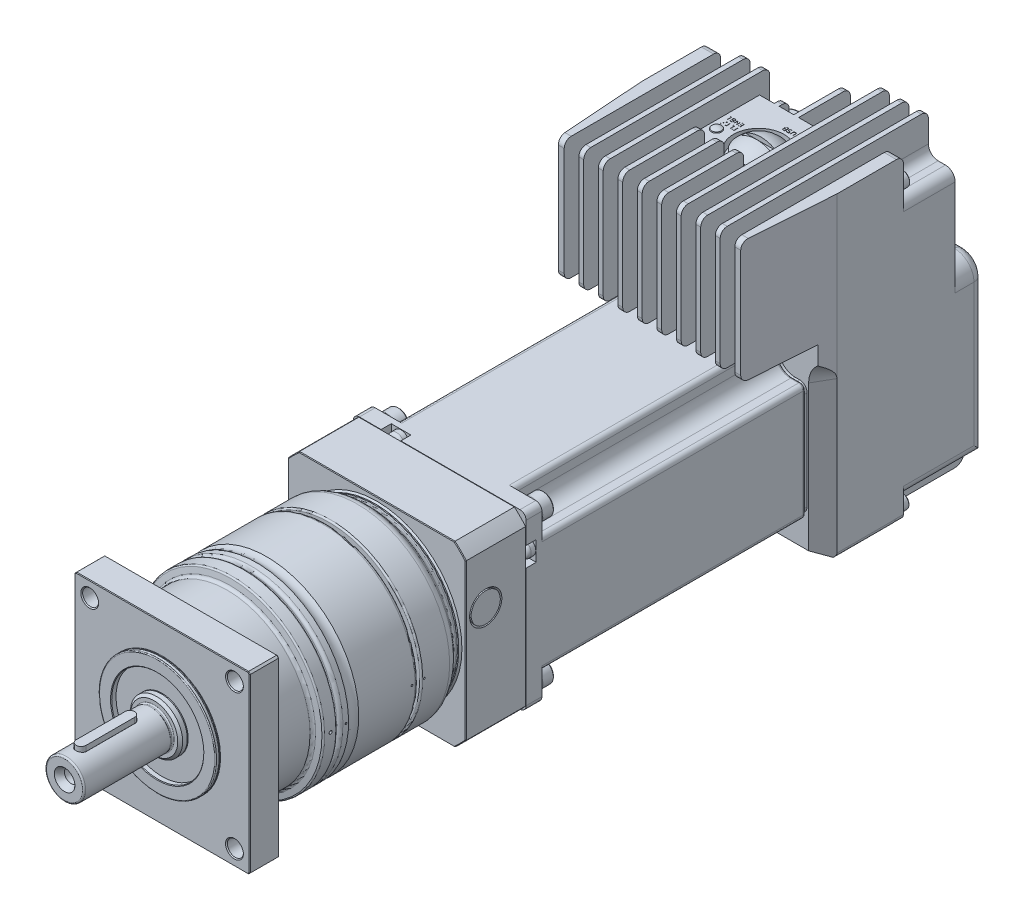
SolidWorks part; units mm, degrees
ref_plane "Front Plane" through (0, 0, 0) normal (0, 0, 1) x (1, 0, 0)
ref_plane "Top Plane" through (0, 0, 0) normal (0, 1, 0) x (1, 0, 0)
ref_plane "Right Plane" through (0, 0, 0) normal (1, 0, 0) x (0, 0, -1)
imported_body "Imported2"
sketch "Sketch1" [suppressed] plane through (0, 0, -90.4) normal (0, 0, 1) x (1, 0, 0)
  line L1 (-71.3389, 100.0776) -> (120.0698, 100.0776)
  line L2 (-71.3389, 100.0776) -> (-71.3389, -132.5696)
  line L3 (-71.3389, -132.5696) -> (120.0698, -132.5696)
  line L4 (120.0698, 100.0776) -> (120.0698, -132.5696)
  circle A0 centre (0, 0) radius 6.35 construction
  circle A1 centre (0, 0) radius 6.35
extrude "Cut-Extrude1" [suppressed] cut sketch "Sketch1" along normal through all
delete or keep bodies "Body-Delete/Keep 1" [suppressed] type delete bodies bodies 104
sketch "Sketch2" [suppressed] plane through (0, 0, -88.9) normal (0, 0, 1) x (1, 0, 0)
  circle A0 centre (0, 0) radius 3.175 construction
  circle A1 centre (0, 0) radius 3.175
  circle A2 centre (0, 0) radius 6.35 construction
  circle A3 centre (0, 0) radius 6.35
extrude "Cut-Extrude2" [suppressed] cut sketch "Sketch2" along normal through all
sketch "Sketch4" plane through (0, 0, -90.4) normal (0, 0, 1) x (1, 0, 0)
  line L0 (-29, 25.3229) -> (-29, -25.3229) construction
  line L1 (-25.3229, -29) -> (25.3229, -29) construction
  line L2 (29, -25.3229) -> (29, 25.3229) construction
  line L3 (25.3229, 29) -> (-25.3229, 29) construction
  line L4 (-29, 25.3229) -> (-29, -25.3229)
  line L5 (-25.3229, -29) -> (25.3229, -29)
  line L6 (29, -25.3229) -> (29, 25.3229)
  line L7 (25.3229, 29) -> (-25.3229, 29)
  arc A0 (-25.3229, 29) -> (-29, 25.3229) centre (0, 0) ccw construction
  arc A1 (-29, -25.3229) -> (-25.3229, -29) centre (0, 0) ccw construction
  arc A2 (25.3229, -29) -> (29, -25.3229) centre (0, 0) ccw construction
  arc A3 (29, 25.3229) -> (25.3229, 29) centre (0, 0) ccw construction
  arc A4 (-25.3229, 29) -> (-29, 25.3229) centre (0, 0) ccw
  arc A5 (-29, -25.3229) -> (-25.3229, -29) centre (0, 0) ccw
  arc A6 (25.3229, -29) -> (29, -25.3229) centre (0, 0) ccw
  arc A7 (29, 25.3229) -> (25.3229, 29) centre (0, 0) ccw
extrude "Cut-Extrude3" cut sketch "Sketch4" along normal blind 0.0003
sketch "Sketch5" plane through (0, 0, -9.525) normal (0, 0, -1) x (-1, 0, 0)
  line L4 (28.375, -27.9088) -> (28.375, 27.9088)
  line L5 (27.9088, 28.375) -> (-27.9088, 28.375)
  line L6 (-28.375, 27.9088) -> (-28.375, -27.9088)
  line L7 (-27.9088, -28.375) -> (27.9088, -28.375)
  line L8 (28.375, -27.9088) -> (28.375, 27.9088)
  line L9 (27.9088, 28.375) -> (-27.9088, 28.375)
  line L10 (-28.375, 27.9088) -> (-28.375, -27.9088)
  line L11 (-27.9088, -28.375) -> (27.9088, -28.375)
  arc A4 (28.375, 27.9088) -> (27.9088, 28.375) centre (0, 0) ccw
  arc A5 (-27.9088, 28.375) -> (-28.375, 27.9088) centre (0, 0) ccw
  arc A6 (-28.375, -27.9088) -> (-27.9088, -28.375) centre (0, 0) ccw
  arc A7 (27.9088, -28.375) -> (28.375, -27.9088) centre (0, 0) ccw
  arc A8 (28.375, 27.9088) -> (27.9088, 28.375) centre (0, 0) ccw
  arc A9 (-27.9088, 28.375) -> (-28.375, 27.9088) centre (0, 0) ccw
  arc A10 (-28.375, -27.9088) -> (-27.9088, -28.375) centre (0, 0) ccw
  arc A11 (27.9088, -28.375) -> (28.375, -27.9088) centre (0, 0) ccw
  dimension "D1" = 0
extrude "Cut-Extrude4" cut sketch "Sketch5" along normal blind 0.0003
sketch "Sketch6" plane through (0, 0, -69.9) normal (0, 0, 1) x (1, 0, 0)
  line L4 (25.2478, 28.8) -> (-25.2478, 28.8)
  line L5 (-28.8, 25.2478) -> (-28.8, -25.2478)
  line L6 (-25.2478, -28.8) -> (25.2478, -28.8)
  line L7 (28.8, -25.2478) -> (28.8, 25.2478)
  line L8 (25.2478, 28.8) -> (-25.2478, 28.8)
  line L9 (-28.8, 25.2478) -> (-28.8, -25.2478)
  line L10 (-25.2478, -28.8) -> (25.2478, -28.8)
  line L11 (28.8, -25.2478) -> (28.8, 25.2478)
  arc A4 (-25.2478, 28.8) -> (-28.8, 25.2478) centre (0, 0) ccw
  arc A5 (-28.8, -25.2478) -> (-25.2478, -28.8) centre (0, 0) ccw
  arc A6 (25.2478, -28.8) -> (28.8, -25.2478) centre (0, 0) ccw
  arc A7 (28.8, 25.2478) -> (25.2478, 28.8) centre (0, 0) ccw
  arc A8 (-25.2478, 28.8) -> (-28.8, 25.2478) centre (0, 0) ccw
  arc A9 (-28.8, -25.2478) -> (-25.2478, -28.8) centre (0, 0) ccw
  arc A10 (25.2478, -28.8) -> (28.8, -25.2478) centre (0, 0) ccw
  arc A11 (28.8, 25.2478) -> (25.2478, 28.8) centre (0, 0) ccw
  dimension "D1" = 0
extrude "Cut-Extrude5" cut sketch "Sketch6" along normal blind 0.0003
